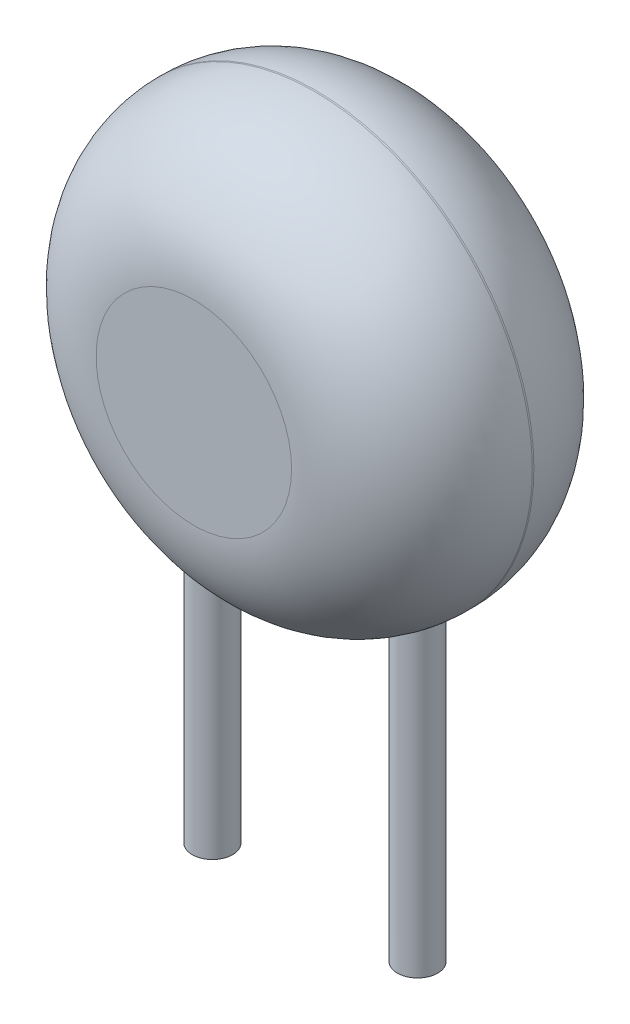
SolidWorks part; units mm, degrees
ref_plane "Plan de face" through (0, 0, 0) normal (0, 0, 1) x (1, 0, 0)
ref_plane "Plan de dessus" through (0, 0, 0) normal (0, 1, 0) x (1, 0, 0)
ref_plane "Plan de droite" through (0, 0, 0) normal (1, 0, 0) x (0, 0, -1)
sketch "Esquisse1" plane through (0, 0, 0) normal (0, 0, 1) x (1, 0, 0)
  line L0 (0, -4.6156) -> (0, 12.0661) construction
  line L1 (8.7787, 0) -> (-7.6319, 0) construction
  circle A0 centre (0, 0) radius 2.7
extrude "Extrusion1" add sketch "Esquisse1" along normal blind 3
fillet "Congé1" radius 1.49 2 edges at (2.7, 0, 0) (2.7, 0, 3)
ref_plane "Plan1" through (0, 0, 0) normal (0, 1, 0) x (-1, 0, 0)
sketch "Esquisse2" plane through (0, 0, 0) normal (0, 1, 0) x (-1, 0, 0)
  line L0 (1.27, 3.6153) -> (1.27, -0.4965) construction
  line L1 (-1.27, 3.6153) -> (-1.27, -0.4965) construction
  line L2 (-3.4539, 0) -> (3.2626, 0) construction
  line L3 (3.2626, 1.5) -> (-1.27, 1.5) construction
  circle A0 centre (-1.27, 1.5) radius 0.25
  circle A1 centre (1.27, 1.5) radius 0.25
  dimension "D1" = 2.54
  dimension "D2" = 1.5
extrude "Extrusion2" add sketch "Esquisse2" against normal blind 6
